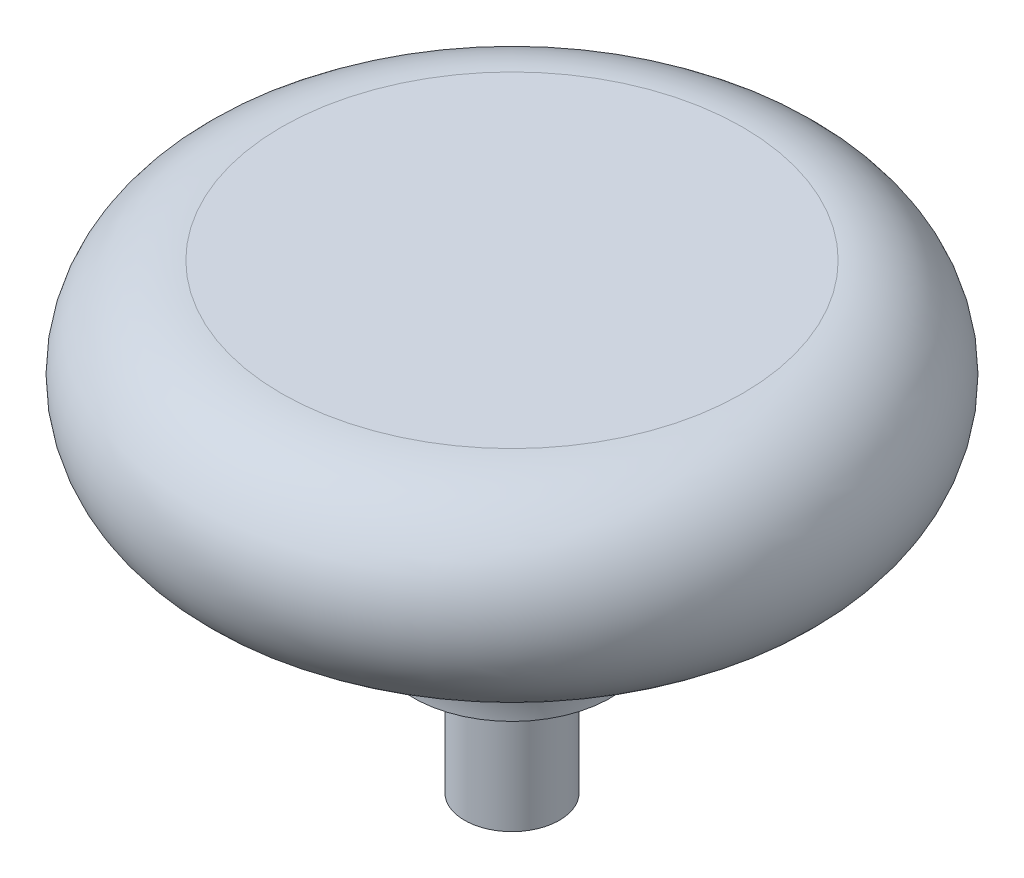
SolidWorks part; units mm, degrees
ref_plane "Front" through (0, 0, 0) normal (0, 0, 1) x (1, 0, 0)
ref_plane "Top" through (0, 0, 0) normal (0, 1, 0) x (-1, 0, 0)
ref_plane "Right" through (0, 0, 0) normal (1, 0, 0) x (0, 0, -1)
sketch "Sketch1" plane through (0, 0, 0) normal (0, 0, 1) x (1, 0, 0)
  line L0 (0, 0) -> (0, 36.2882) construction
  line L1 (0, 0) -> (0, 22.225)
  line L2 (0, 22.225) -> (11.1125, 22.225)
  line L4 (4.7625, 6.35) -> (2.286, 6.35)
  line L5 (2.286, 6.35) -> (2.286, 0)
  line L6 (2.286, 0) -> (0, 0)
  arc A0 (11.1125, 22.225) -> (11.1125, 12.7) centre (11.1125, 17.4625) cw
  arc A1 (11.1125, 12.7) -> (4.7625, 6.35) centre (11.1125, 6.35) ccw
  dimension "D5" = 6.35
  dimension "D6" = 4.7625
  dimension "D1" = 4.572
  dimension "D2" = 4.7625
  dimension "D3" = 6.35
  dimension "D4" = 15.875
revolve "Base-Revolve" add sketch "Sketch1" angle 360 about L0
